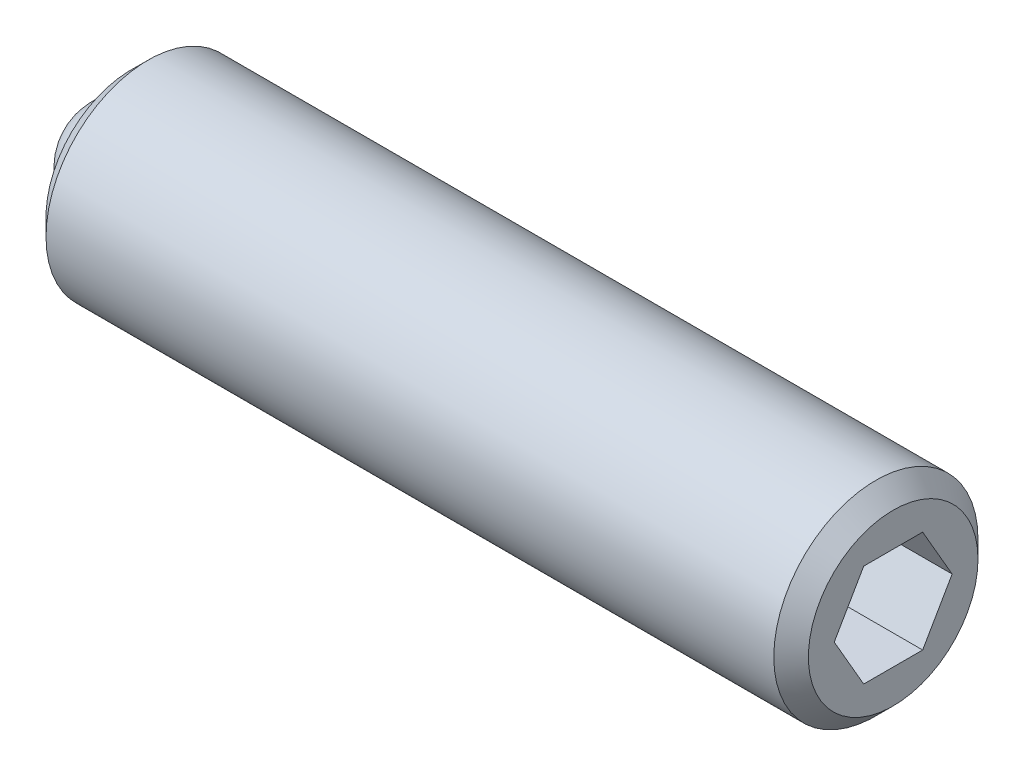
SolidWorks part; units mm, degrees
ref_plane "Front Plane" through (0, 0, 0) normal (0, 0, 1) x (1, 0, 0)
ref_plane "Top Plane" through (0, 0, 0) normal (0, 1, 0) x (1, 0, 0)
ref_plane "Right Plane" through (0, 0, 0) normal (1, 0, 0) x (0, 0, -1)
sketch "Sketch2" plane through (0, 0, 0) normal (1, 0, 0) x (0, 0, -1)
  circle A0 centre (0, 0) radius 1.5
  dimension "D1" = 3
extrude "Boss-Extrude1" add sketch "Sketch2" along normal blind 11.2
sketch "Sketch3" plane through (0, 0, 0) normal (-1, 0, 0) x (0, 0, 1)
  circle A0 centre (0, 0) radius 0.8
  dimension "D1" = 1.6
chamfer "Chamfer1" distance 0.254 angle 45 1 edges at (0, 0, -1.5)
chamfer "Chamfer2" distance 0.254 angle 45 1 edges at (11.2, 0, -1.5)
sketch "Sketch4" plane through (11.2, 0, 0) normal (1, 0, 0) x (0, 0, -1)
  line L1 (0.866, 0) -> (0.433, 0.75)
  line L2 (0.433, 0.75) -> (-0.433, 0.75)
  line L3 (-0.433, 0.75) -> (-0.866, 0)
  line L4 (-0.866, 0) -> (-0.433, -0.75)
  line L5 (-0.433, -0.75) -> (0.433, -0.75)
  line L6 (0.433, -0.75) -> (0.866, 0)
  circle A0 centre (0, 0) radius 0.75 construction
  dimension "D1" = 1.5
extrude "Cut-Extrude2" cut sketch "Sketch4" against normal blind 2
extrude "Cut-Extrude3" cut sketch "Sketch3" against normal blind 0.8
sketch "Sketch5" plane through (0, 0, 0) normal (-1, 0, 0) x (0, 0, 1)
  line L0 (0, 0) -> (0, -0.8)
  line L1 (0, 0) -> (0, 0.8)
  arc A0 (0, 0.8) -> (0, -0.8) centre (0, 0) ccw
  dimension "D1" = 0.8
revolve "Revolve1" add sketch "Sketch5" angle 360 about L1
sketch "Sketch7" plane through (0, 0, 0) normal (-1, 0, 0) x (0, 0, 1)
  line L0 (0, 0) -> (0, 0.8) construction
  arc A0 (0.0634, 0.7975) -> (-0.0634, 0.7975) centre (0, 0) ccw
  arc A1 (0.0634, 0.7975) -> (-0.0634, 0.7975) centre (0, 0.8) ccw
  dimension "D1" = 1.6
  dimension "D2" = 0.127
extrude "Cut-Extrude4" cut sketch "Sketch7" against normal up to surface (0.8 mm away) contours A1 A0
